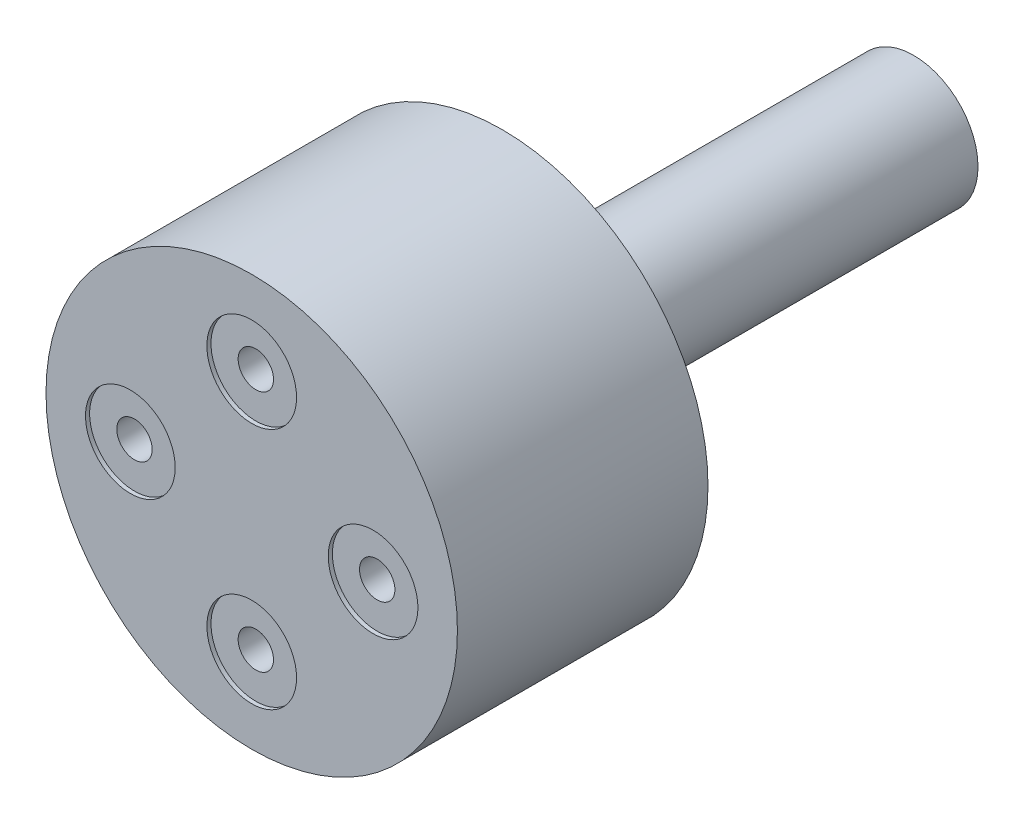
SolidWorks part; units mm, degrees
ref_plane "Plane1" through (0, 0, 0) normal (0, 0, 1) x (1, 0, 0)
ref_plane "Plane2" through (0, 0, 0) normal (0, 1, 0) x (1, 0, 0)
ref_plane "Plane3" through (0, 0, 0) normal (1, 0, 0) x (0, 0, -1)
imported_body "Imported1"
sketch "Sketch1" plane through (0, 0, 20.4343) normal (0, 0, 1) x (1, 0, 0)
  circle A0 centre (0, 0) radius 12.7
  circle A1 centre (0, 0) radius 12.7 construction
extrude "Extrude1" add sketch "Sketch1" against normal up to surface (2.54 mm away)
sketch "Sketch2" plane through (0, 0, 20.4343) normal (0, 0, 1) x (1, 0, 0)
  line L0 (0, 0) -> (0, 12.7) construction
  line L1 (0, 0) -> (12.7, 0) construction
  circle A0 centre (0, 0) radius 12.7 construction
  circle A1 centre (0, 7.493) radius 1.0922
  circle A2 centre (7.493, 0) radius 1.0922
  circle A3 centre (0, -7.493) radius 1.0922
  circle A4 centre (-7.493, 0) radius 1.0922
  dimension "D1" = 2.1844
  dimension "D2" = 2.1844
  dimension "D3" = 7.493
  dimension "D4" = 7.493
extrude "Cut-Extrude1" cut sketch "Sketch2" against normal blind 6.35
sketch "Sketch3" plane through (0, 0, 20.4343) normal (0, 0, 1) x (1, 0, 0)
  circle A0 centre (0, 7.493) radius 2.7686
  circle A1 centre (-7.493, 0) radius 2.7686
  circle A2 centre (0, -7.493) radius 2.7686
  circle A3 centre (7.493, 0) radius 2.7686
  dimension "D1" = 5.5372
extrude "Cut-Extrude2" cut sketch "Sketch3" against normal blind 0.254
